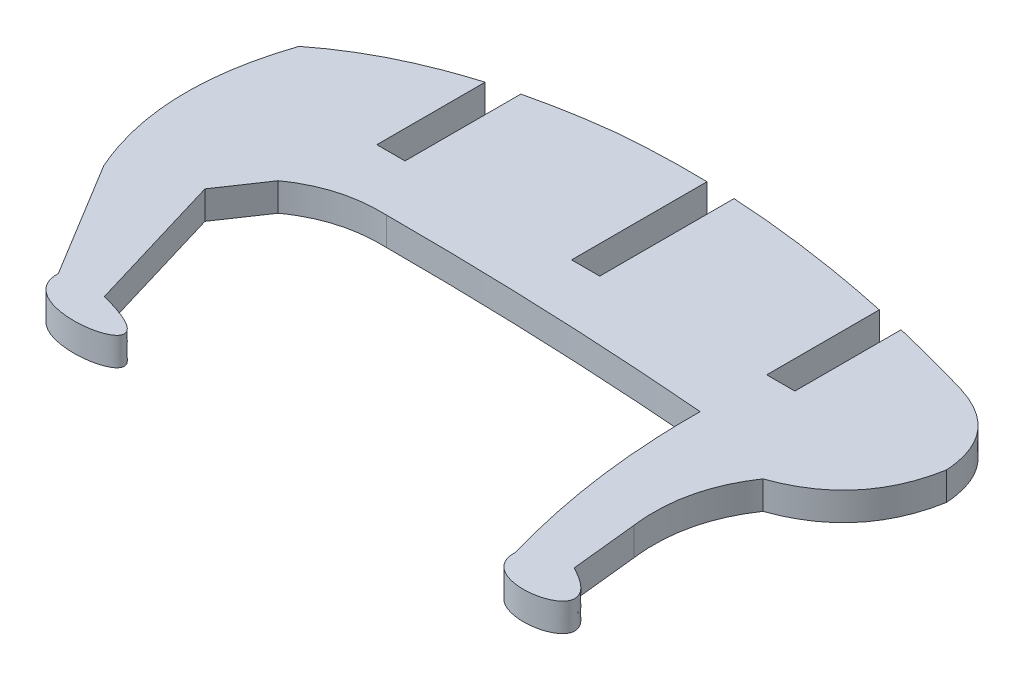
SolidWorks part; units mm, degrees
ref_plane "Alzado" through (0, 0, 0) normal (0, 0, 1) x (1, 0, 0)
ref_plane "Planta" through (0, 0, 0) normal (0, 1, 0) x (1, 0, 0)
ref_plane "Vista lateral" through (0, 0, 0) normal (1, 0, 0) x (0, 0, -1)
sketch "Croquis2" plane through (0, 0, 0) normal (0, 1, 0) x (1, 0, 0)
  line L0 (-20.4658, 21.7939) -> (56.8, 21.7939) construction
  line L1 (55.0566, 13.5654) -> (55.2406, 13.232)
  line L3 (-7.2337, 4.6437) -> (-10.3742, 0)
  line L7 (36.7066, 24.7648) -> (36.7066, 12.7675)
  line L8 (36.7066, 12.7675) -> (39.7066, 12.7675)
  line L9 (39.7066, 24.0872) -> (39.7066, 12.7675)
  line L10 (15.7066, 27.4047) -> (15.7066, 12.9789)
  line L11 (15.7066, 12.9789) -> (18.7066, 12.9789)
  line L12 (18.7066, 27.2854) -> (18.7066, 12.9789)
  line L14 (-5.2934, 24.7651) -> (-5.2934, 13.232)
  line L15 (-5.2934, 13.232) -> (-2.2934, 13.232)
  line L16 (-2.2934, 25.5718) -> (-2.2934, 13.232)
  line L17 (-23.4305, 13.232) -> (76.1186, 13.232) construction
  line L18 (43.5159, -8.1867) -> (44.266, -15.3027)
  spline S0 degree 3 poles (6.2373, 27.0797) (9.2708, 27.3726) (12.4273, 27.4809) (15.7066, 27.4047) knots 0.396666 0.396666 0.396666 0.396666 0.54813 0.54813 0.54813 0.54813
  spline S1 degree 2 poles (48.3379, 21.7939) (54.6503, 19.8549) (55.0566, 13.5654) knots 0 0 0 1 1 1
  spline S2 degree 2 poles (-18.5169, 18.1508) (-22.3382, 6.7806) (-17.9077, -3.244) knots 0 0 0 1 1 1
  spline S3 degree 2 poles (49.1349, 4.3934) (48.9355, 4.521) (48.7312, 4.6437) knots 0.945544 0.945544 0.945544 1 1 1
  spline S4 degree 3 poles (36.5574, 5.8293) (24.9501, 6.7895) (13.3291, 7.2646) (1.6945, 7.2544) knots 0.259121 0.259121 0.259121 0.259121 1 1 1 1
  spline S5 degree 2 poles (-2.2934, 25.5718) (1.9362, 26.5899) (6.2373, 27.0797) knots 0.783563 0.783563 0.783563 1 1 1
  spline S6 degree 2 poles (1.6945, 7.2544) (-3.3871, 7.432) (-7.2337, 4.6437) knots 0 0 0 1 1 1
  spline S9 degree 3 poles (-18.5169, 18.1508) (-16.0294, 20.1252) (-11.7184, 22.5793) (-7.0243, 24.2476) (-5.2934, 24.7651) knots 0.333246 0.333246 0.333246 0.333246 0.571138 0.706216 0.706216 0.706216 0.706216
  spline S10 degree 3 poles (18.7066, 27.2854) (24.3576, 26.9694) (30.3576, 26.1291) (36.7066, 24.7648) knots 0.593802 0.593802 0.593802 0.593802 0.849041 0.849041 0.849041 0.849041
  spline S11 degree 2 poles (39.7066, 24.0872) (43.9231, 23.0895) (48.3379, 21.7939) knots 0.888901 0.888901 0.888901 1 1 1
  spline S12 degree 2 poles (55.0566, 13.5654) (53.6456, 5.6124) (46.0998, 2.964) knots 0 0 0 1 1 1
  spline S13 degree 2 poles (46.0998, 2.964) (42.7204, -1.9957) (43.5159, -8.1867) knots 0 0 0 1 1 1
  spline S14 degree 3 poles (44.266, -15.3027) (52.8213, -19.6285) (39.3854, -22.4233) (39.7066, -16.9764) knots 0 0 0 0 1 1 1 1
  spline S15 degree 2 poles (39.7066, -16.9764) (36.4198, -5.7458) (36.5574, 5.8293) knots 0 0 0 1 1 1
  spline S16 degree 1 poles (-17.9077, -3.244) (-10.3742, -15.6176) knots 0 0 1 1
  spline S17 degree 3 poles (-10.3742, -15.6176) (-10.5918, -22.0077) (6.6128, -18.3702) (-5.7934, -15.3027) knots 0 0 0 0 1 1 1 1
  spline S18 degree 1 poles (-5.7934, -15.3027) (-10.3742, 0) knots 0 0 1 1
  dimension "D4" = 18
  dimension "D5" = 18
extrude "Saliente-Extruir1" add sketch "Croquis2" along normal blind 3 contours S12 S13 L18 S14 S15 S4 S6 L3 S18 S17 S16 S2 S9 L14 L15 L16 S5 S0 L10 L11 L12 S10 L7 L8 L9 S11 S1
